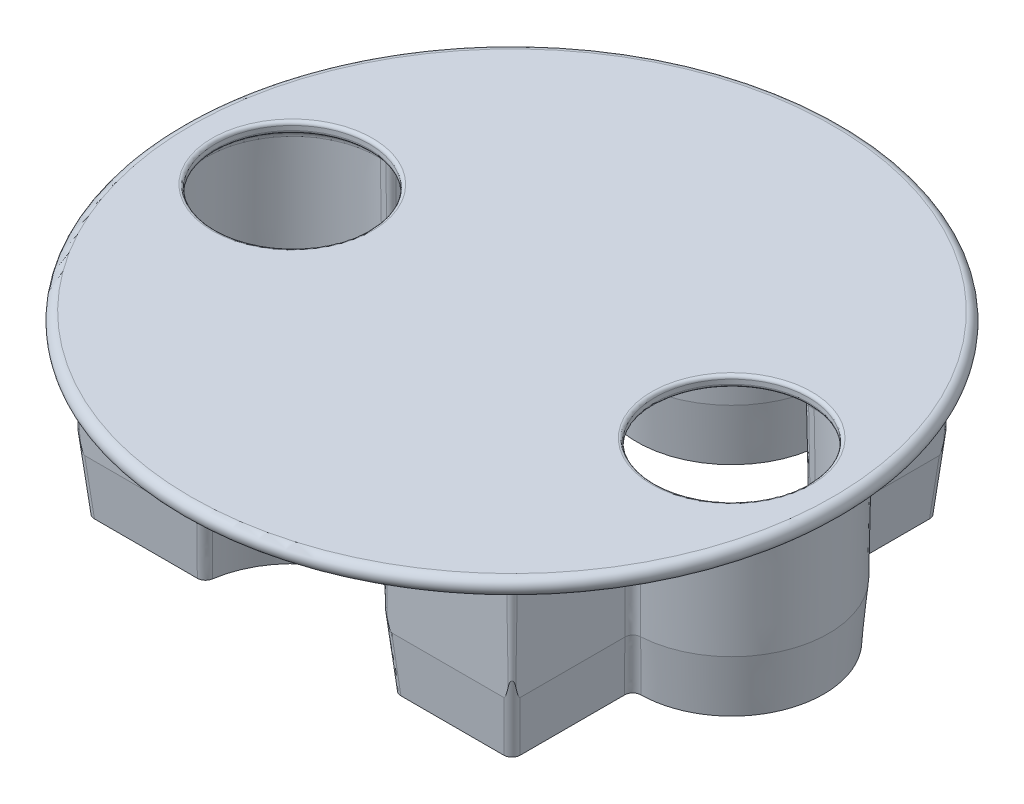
SolidWorks part; units mm, degrees
ref_plane "Front Plane" through (0, 0, 0) normal (0, 0, 1) x (1, 0, 0)
ref_plane "Top Plane" through (0, 0, 0) normal (0, 1, 0) x (1, 0, 0)
ref_plane "Right Plane" through (0, 0, 0) normal (1, 0, 0) x (0, 0, -1)
ref_plane "Plane2" through (0, 0, 0) normal (0, 0, 1) x (1, 0, 0)
sketch "Sketch2" plane through (0, 0, 0) normal (0, 0, 1) x (1, 0, 0)
  line L0 (0, 59.074) -> (0, -67.3792) construction
  line L1 (-69.3886, 0) -> (68.8527, 0) construction
  line L2 (0, 0) -> (-58.5, 0)
  line L6 (-57.0858, -2) -> (0, -2)
  line L7 (0, -2) -> (0, 0)
  arc A0 (-58.5, 0) -> (-57.0858, -2) centre (-58.5, -1.5) ccw
  dimension "D3" = 1.5
  dimension "D1" = 2
  dimension "D2" = 58.5
revolve "Revolve2" add sketch "Sketch2" angle 360 about L0
ref_plane "Plane4" through (0, -2, 0) normal (0, -1, 0) x (-1, 0, 0)
sketch "Sketch3" plane through (0, -2, 0) normal (0, -1, 0) x (-1, 0, 0)
  line L0 (0, -66.5996) -> (0, 65.449) construction
  line L1 (-68.0376, 0) -> (66.6735, 0) construction
  line L2 (39, -40) -> (16.9706, -40)
  line L3 (40, -39) -> (40, -18)
  line L4 (37.5, -37.5) -> (37.5, -16.4919)
  line L5 (37.5, -37.5) -> (18.3303, -37.5)
  line L6 (40, -40) -> (16, -40) construction
  line L7 (40, -40) -> (40, -18) construction
  line L8 (-38.5, -15.4919) -> (-39.5, -15.4919)
  line L9 (38.5, -15.4919) -> (39.5, -15.4919)
  line L10 (37.5, -37.5) -> (37.5, -15.2971) construction
  line L11 (-37.5, -37.5) -> (-18.3303, -37.5)
  line L12 (-37.5, -37.5) -> (-37.5, -16.4919)
  line L13 (-40, -39) -> (-40, -18)
  line L14 (-39, -40) -> (-16.9706, -40)
  line L15 (0, 66.5996) -> (0, -65.449) construction
  line L16 (-39, 40) -> (-16.9706, 40)
  line L17 (-40, 39) -> (-40, 18)
  line L18 (-37.5, 37.5) -> (-37.5, 16.4919)
  line L19 (-37.5, 37.5) -> (-18.3303, 37.5)
  line L20 (38.5, 15.4919) -> (39.5, 15.4919)
  line L21 (-38.5, 15.4919) -> (-39.5, 15.4919)
  line L22 (37.5, 37.5) -> (18.3303, 37.5)
  line L23 (37.5, 37.5) -> (37.5, 16.4919)
  line L24 (40, 39) -> (40, 18)
  line L25 (39, 40) -> (16.9706, 40)
  arc A0 (15.9723, -39.0588) -> (-15.9723, -39.0588) centre (0, -40) ccw
  arc A1 (40, -18) -> (40, 18) centre (40, 0) ccw
  arc A2 (39.5, -15.4919) -> (39.5, 15.4919) centre (40, 0) ccw
  arc A3 (18.3303, -37.5) -> (0, -21.5) centre (0, -40) ccw
  arc A4 (39, -40) -> (40, -39) centre (39, -39) ccw
  arc A5 (-38.5, -15.4919) -> (-37.5, -16.4919) centre (-38.5, -16.4919) cw
  arc A6 (-16.9706, -40) -> (-15.9723, -39.0588) centre (-16.9706, -39) ccw
  arc A7 (40, -18) -> (58, 0) centre (40, 0) ccw construction
  arc A8 (16, -40) -> (0, -24) centre (0, -40) ccw construction
  arc A9 (16.9706, -40) -> (15.9723, -39.0588) centre (16.9706, -39) cw
  arc A10 (37.5, -15.2971) -> (55.5, 0) centre (40, 0) ccw construction
  arc A11 (38.5, -15.4919) -> (37.5, -16.4919) centre (38.5, -16.4919) ccw
  arc A12 (-39, -40) -> (-40, -39) centre (-39, -39) cw
  arc A13 (-18.3303, -37.5) -> (0, -21.5) centre (0, -40) cw
  arc A14 (-39.5, -15.4919) -> (-39.5, 15.4919) centre (-40, 0) cw
  arc A15 (-40, -18) -> (-40, 18) centre (-40, 0) cw
  arc A16 (-18.3303, 37.5) -> (0, 21.5) centre (0, 40) ccw
  arc A17 (-39, 40) -> (-40, 39) centre (-39, 39) ccw
  arc A18 (38.5, 15.4919) -> (37.5, 16.4919) centre (38.5, 16.4919) cw
  arc A19 (16.9706, 40) -> (15.9723, 39.0588) centre (16.9706, 39) ccw
  arc A20 (-16.9706, 40) -> (-15.9723, 39.0588) centre (-16.9706, 39) cw
  arc A21 (-38.5, 15.4919) -> (-37.5, 16.4919) centre (-38.5, 16.4919) ccw
  arc A22 (39, 40) -> (40, 39) centre (39, 39) cw
  arc A23 (18.3303, 37.5) -> (0, 21.5) centre (0, 40) cw
  arc A24 (15.9723, 39.0588) -> (-15.9723, 39.0588) centre (0, 40) cw
  dimension "D1" = 18
  dimension "D4" = 16
  dimension "D6" = 1
  dimension "D7" = 1
  dimension "D10" = 1
  dimension "D11" = 1
  dimension "D2" = 40
  dimension "D3" = 40
  dimension "D5" = 2.5
ref_plane "Plane5" through (0, -2, 0) normal (0, -1, 0) x (-1, 0, 0)
sketch "Sketch4" plane through (0, -2, 0) normal (0, -1, 0) x (-1, 0, 0)
  circle A0 centre (40, 0) radius 14
  circle A2 centre (-40, 0) radius 14
  circle A4 centre (0, 40) radius 14
  circle A5 centre (0, -40) radius 14
  point P13 (0, 0)
  dimension "D1" = 28
  dimension "D2" = 40
  dimension "D3" = 4
extrude "Cut-Extrude1" cut sketch "Sketch4" against normal blind 2
extrude "Boss-Extrude2" add sketch "Sketch3" along normal blind 20 draft 1
ref_plane "Plane6" through (0, -22, 0) normal (0, -1, 0) x (-1, 0, 0)
sketch "Sketch5" plane through (0, -22, 0) normal (0, -1, 0) x (-1, 0, 0)
  line L8 (-16.9706, 39.6509) -> (-39, 39.6509) construction
  line L9 (-39.6509, 39) -> (-39.6509, 17.6474) construction
  line L10 (-39.6509, -17.6474) -> (-39.6509, -39) construction
  line L11 (-39, -39.6509) -> (-16.9706, -39.6509) construction
  line L12 (16.9706, -39.6509) -> (39, -39.6509) construction
  line L13 (39.6509, -39) -> (39.6509, -17.6474) construction
  line L14 (38.5, -15.841) -> (39.4944, -15.841) construction
  line L15 (39, 39.6509) -> (16.9706, 39.6509) construction
  line L16 (39.6509, 17.6474) -> (39.6509, 39) construction
  line L17 (39.4944, 15.841) -> (38.5, 15.841) construction
  line L18 (37.8491, 16.4919) -> (37.8491, 37.8491) construction
  line L19 (37.8491, 37.8491) -> (18.023, 37.8491) construction
  line L20 (-18.023, 37.8491) -> (-37.8491, 37.8491) construction
  line L21 (-37.8491, 37.8491) -> (-37.8491, 16.4919) construction
  line L22 (-38.5, 15.841) -> (-39.4944, 15.841) construction
  line L23 (-39.4944, -15.841) -> (-38.5, -15.841) construction
  line L24 (-37.8491, -16.4919) -> (-37.8491, -37.8491) construction
  line L25 (-37.8491, -37.8491) -> (-18.023, -37.8491) construction
  line L26 (37.8491, -37.8491) -> (37.8491, -16.4919) construction
  line L27 (18.023, -37.8491) -> (37.8491, -37.8491) construction
  line L28 (-16.9706, 39.6509) -> (-39, 39.6509)
  line L29 (-39.6509, 39) -> (-39.6509, 17.6474)
  line L30 (-39.6509, -17.6474) -> (-39.6509, -39)
  line L31 (-39, -39.6509) -> (-16.9706, -39.6509)
  line L32 (16.9706, -39.6509) -> (39, -39.6509)
  line L33 (39.6509, -39) -> (39.6509, -17.6474)
  line L34 (38.5, -15.841) -> (39.4944, -15.841)
  line L35 (39, 39.6509) -> (16.9706, 39.6509)
  line L36 (39.6509, 17.6474) -> (39.6509, 39)
  line L37 (39.4944, 15.841) -> (38.5, 15.841)
  line L38 (37.8491, 16.4919) -> (37.8491, 37.8491)
  line L39 (37.8491, 37.8491) -> (18.023, 37.8491)
  line L40 (-18.023, 37.8491) -> (-37.8491, 37.8491)
  line L41 (-37.8491, 37.8491) -> (-37.8491, 16.4919)
  line L42 (-38.5, 15.841) -> (-39.4944, 15.841)
  line L43 (-39.4944, -15.841) -> (-38.5, -15.841)
  line L44 (-37.8491, -16.4919) -> (-37.8491, -37.8491)
  line L45 (-37.8491, -37.8491) -> (-18.023, -37.8491)
  line L46 (37.8491, -37.8491) -> (37.8491, -16.4919)
  line L47 (18.023, -37.8491) -> (37.8491, -37.8491)
  arc A12 (-16.3208, 39.0383) -> (-16.9706, 39.6509) centre (-16.9706, 39) ccw construction
  arc A13 (-39, 39.6509) -> (-39.6509, 39) centre (-39, 39) ccw construction
  arc A14 (-39.6509, 17.6474) -> (-39.6509, -17.6474) centre (-40, 0) ccw construction
  arc A15 (-39.6509, -39) -> (-39, -39.6509) centre (-39, -39) ccw construction
  arc A16 (-16.9706, -39.6509) -> (-16.3208, -39.0383) centre (-16.9706, -39) ccw construction
  arc A17 (16.3208, -39.0383) -> (-16.3208, -39.0383) centre (0, -40) ccw construction
  arc A18 (16.3208, -39.0383) -> (16.9706, -39.6509) centre (16.9706, -39) ccw construction
  arc A19 (39, -39.6509) -> (39.6509, -39) centre (39, -39) ccw construction
  arc A20 (38.5, -15.841) -> (37.8491, -16.4919) centre (38.5, -16.4919) ccw construction
  arc A21 (-16.3208, 39.0383) -> (16.3208, 39.0383) centre (0, 40) ccw construction
  arc A22 (16.9706, 39.6509) -> (16.3208, 39.0383) centre (16.9706, 39) ccw construction
  arc A23 (39.6509, 39) -> (39, 39.6509) centre (39, 39) ccw construction
  arc A24 (39.6509, -17.6474) -> (39.6509, 17.6474) centre (40, 0) ccw construction
  arc A25 (39.4944, -15.841) -> (39.4944, 15.841) centre (40, 0) ccw construction
  arc A26 (37.8491, 16.4919) -> (38.5, 15.841) centre (38.5, 16.4919) ccw construction
  arc A27 (-18.023, 37.8491) -> (18.023, 37.8491) centre (0, 40) ccw construction
  arc A28 (-38.5, 15.841) -> (-37.8491, 16.4919) centre (-38.5, 16.4919) ccw construction
  arc A29 (-39.4944, 15.841) -> (-39.4944, -15.841) centre (-40, 0) ccw construction
  arc A30 (-37.8491, -16.4919) -> (-38.5, -15.841) centre (-38.5, -16.4919) ccw construction
  arc A31 (18.023, -37.8491) -> (-18.023, -37.8491) centre (0, -40) ccw construction
  arc A32 (-16.3208, 39.0383) -> (-16.9706, 39.6509) centre (-16.9706, 39) ccw
  arc A33 (-39, 39.6509) -> (-39.6509, 39) centre (-39, 39) ccw
  arc A34 (-39.6509, 17.6474) -> (-39.6509, -17.6474) centre (-40, 0) ccw
  arc A35 (-39.6509, -39) -> (-39, -39.6509) centre (-39, -39) ccw
  arc A36 (-16.9706, -39.6509) -> (-16.3208, -39.0383) centre (-16.9706, -39) ccw
  arc A37 (16.3208, -39.0383) -> (-16.3208, -39.0383) centre (0, -40) ccw
  arc A38 (16.3208, -39.0383) -> (16.9706, -39.6509) centre (16.9706, -39) ccw
  arc A39 (39, -39.6509) -> (39.6509, -39) centre (39, -39) ccw
  arc A40 (38.5, -15.841) -> (37.8491, -16.4919) centre (38.5, -16.4919) ccw
  arc A41 (-16.3208, 39.0383) -> (16.3208, 39.0383) centre (0, 40) ccw
  arc A42 (16.9706, 39.6509) -> (16.3208, 39.0383) centre (16.9706, 39) ccw
  arc A43 (39.6509, 39) -> (39, 39.6509) centre (39, 39) ccw
  arc A44 (39.6509, -17.6474) -> (39.6509, 17.6474) centre (40, 0) ccw
  arc A45 (39.4944, -15.841) -> (39.4944, 15.841) centre (40, 0) ccw
  arc A46 (37.8491, 16.4919) -> (38.5, 15.841) centre (38.5, 16.4919) ccw
  arc A47 (-18.023, 37.8491) -> (18.023, 37.8491) centre (0, 40) ccw
  arc A48 (-38.5, 15.841) -> (-37.8491, 16.4919) centre (-38.5, 16.4919) ccw
  arc A49 (-39.4944, 15.841) -> (-39.4944, -15.841) centre (-40, 0) ccw
  arc A50 (-37.8491, -16.4919) -> (-38.5, -15.841) centre (-38.5, -16.4919) ccw
  arc A51 (18.023, -37.8491) -> (-18.023, -37.8491) centre (0, -40) ccw
extrude "Boss-Extrude3" add sketch "Sketch5" along normal blind 10 draft 5.1
fillet "Fillet1" radius 0.6 4 edges at (40, 0, -14) (40, -2, -14) (-40, 0, -14) (-40, -2, -14)
fillet "Fillet2" radius 1.5 28 edges at (-40, -2, -28.5) (-39.7071, -2, -39.7071) (-27.9853, -2, -40) (-16.2846, -2, -39.7276) (0, -2, -24) (16.2846, -2, -39.7276) (27.9853, -2, -40) (39.7071, -2, -39.7071) (-40, -2, 28.5) (-39.7071, -2, 39.7071) (-27.9853, -2, 40) (-16.2846, -2, 39.7276) (0, -2, 24) (16.2846, -2, 39.7276) (27.9853, -2, 40) (39.7071, -2, 39.7071) (-50.0605, -2, -14.926) (40, -2, -28.5) (50.0605, -2, 14.926) (40, -2, 28.5)
fillet "Fillet3" radius 1.5 36 edges at (39, -2, 15.4919) (37.7929, -2, 15.7848) (-39, -2, 15.4919) (-37.7929, -2, 15.7848) (-39, -2, -15.4919) (-37.7929, -2, -15.7848) (39, -2, -15.4919) (37.7929, -2, -15.7848) (-37.6746, -12, 37.6746) (37.6746, -12, 37.6746) (37.6746, -12, -37.6746) (-37.6746, -12, -37.6746) (-27.9152, -2, -37.5) (27.9152, -2, -37.5) (-27.9152, -2, 37.5) (0, -2, 21.5) (27.9152, -2, 37.5) (55.5, -2, 0) (37.5, -2, 26.996) (-55.5, -2, 0) (-37.5, -2, 26.996) (-37.5, -2, -26.996) (37.5, -2, -26.996) (0, -2, -21.5) (38.2953, -27, 38.2953) (38.2953, -27, -38.2953) (-38.2953, -27, 38.2953) (-38.2953, -27, -38.2953)
fillet "Fillet4" radius 1.5 12 edges at (-38.6208, -30.6466, -16.6127) (38.6208, -30.6466, -16.6127) (38.6208, -30.6466, 16.6127) (-38.6208, -30.6466, 16.6127) (-38.8792, -30.6466, -38.8792) (38.8792, -30.6466, -38.8792) (38.8792, -30.6466, 38.8792) (-38.8792, -30.6466, 38.8792)
